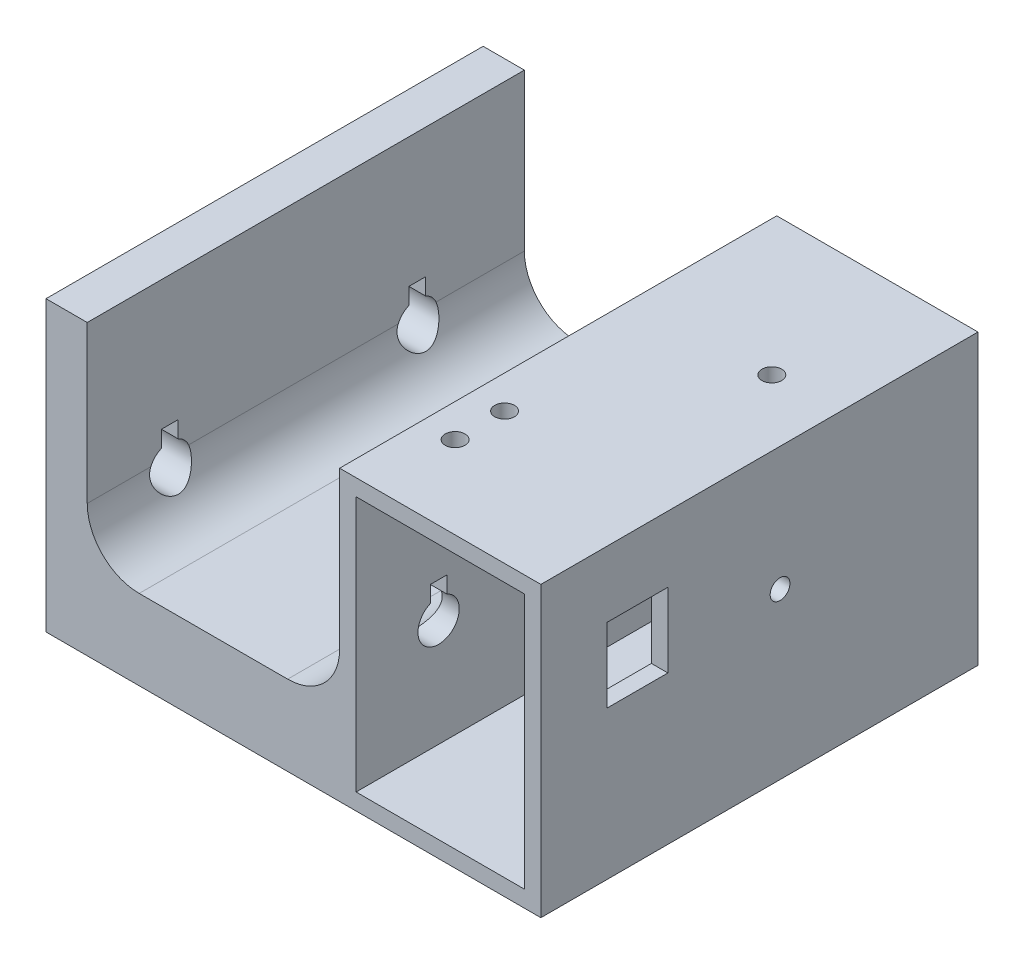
SolidWorks part; units mm, degrees
ref_plane "Front Plane" through (0, 0, 0) normal (0, 0, 1) x (1, 0, 0)
ref_plane "Top Plane" through (0, 0, 0) normal (0, 1, 0) x (1, 0, 0)
ref_plane "Right Plane" through (0, 0, 0) normal (1, 0, 0) x (0, 0, -1)
sketch "Sketch1" plane through (0, 0, 0) normal (0, 0, 1) x (1, 0, 0)
  line L0 (45.212, 44.45) -> (76.2, 44.45)
  line L1 (0, 0) -> (76.2, 0)
  line L2 (0, 0) -> (0, 44.45)
  line L3 (0, 44.45) -> (6.35, 44.45)
  line L4 (76.2, 0) -> (76.2, 44.45)
  line L6 (6.35, 44.45) -> (6.35, 20.32)
  line L7 (14.351, 12.319) -> (37.211, 12.319)
  line L8 (45.212, 44.45) -> (45.212, 20.32)
  arc A0 (37.211, 12.319) -> (45.212, 20.32) centre (37.211, 20.32) ccw
  arc A1 (6.35, 20.32) -> (14.351, 12.319) centre (14.351, 20.32) ccw
  point P11 (45.212, 12.319)
  point P14 (6.35, 12.319)
  dimension "D6" = 8.001
  dimension "D1" = 44.45
  dimension "D2" = 76.2
  dimension "D3" = 38.862
  dimension "D4" = 6.35
  dimension "D5" = 32.131
extrude "Boss-Extrude1" add sketch "Sketch1" along normal blind 67.31
sketch "Sketch3" plane through (0, 44.45, 0) normal (0, 1, 0) x (1, 0, 0)
  line L0 (45.212, -67.31) -> (45.212, 0) construction
  line L1 (76.2, 0) -> (45.212, 0) construction
  circle A0 centre (68.9864, -6.35) radius 1.5875
  dimension "D2" = 3.175
  dimension "D1" = 23.7744
  dimension "D3" = 6.35
extrude "Cut-Extrude2" [suppressed] cut sketch "Sketch3" against normal blind 12.7
sketch "Sketch4" plane through (0, 0, 67.31) normal (0, 0, 1) x (1, 0, 0)
  line L0 (76.2, 44.45) -> (45.212, 44.45) construction
  line L1 (47.752, 41.91) -> (73.66, 41.91)
  line L2 (47.752, 41.91) -> (47.752, 2.54)
  line L3 (47.752, 2.54) -> (73.66, 2.54)
  line L4 (73.66, 41.91) -> (73.66, 2.54)
  line L5 (76.2, 0) -> (76.2, 44.45) construction
  line L6 (0, 0) -> (76.2, 0) construction
  line L7 (45.212, 44.45) -> (45.212, 20.32) construction
  dimension "D1" = 2.54
  dimension "D2" = 2.54
  dimension "D3" = 2.54
  dimension "D4" = 2.54
extrude "Cut-Extrude3" cut sketch "Sketch4" against normal blind 63.5
sketch "Sketch2" plane through (0, 0, 0) normal (-1, 0, 0) x (0, 0, 1)
  line L0 (67.31, 44.45) -> (67.31, 0) construction
  line L1 (67.31, 44.45) -> (0, 44.45) construction
  line L2 (15.24, 21.9599) -> (15.24, 24.4999)
  line L3 (15.24, 24.4999) -> (17.78, 24.4999)
  line L4 (17.78, 24.4999) -> (17.78, 21.9599)
  line L5 (53.34, 21.9599) -> (53.34, 24.4999)
  line L6 (53.34, 24.4999) -> (55.88, 24.4999)
  line L7 (55.88, 24.4999) -> (55.88, 21.9599)
  arc A0 (53.34, 21.9599) -> (55.88, 21.9599) centre (54.61, 19.05) ccw
  arc A1 (15.24, 21.9599) -> (17.78, 21.9599) centre (16.51, 19.05) ccw
  dimension "D1" = 6.35
  dimension "D2" = 6.35
  dimension "D3" = 12.7
  dimension "D4" = 38.1
  dimension "D5" = 25.4
  dimension "D6" = 25.4
  dimension "D7" = 2.54
  dimension "D8" = 1.27
  dimension "D9" = 2.54
  dimension "D10" = 2.54
  dimension "D11" = 1.27
  dimension "D12" = 2.54
extrude "Cut-Extrude1" cut sketch "Sketch2" against normal up to surface (47.752 mm away)
sketch "Sketch5" plane through (0, 44.45, 0) normal (0, 1, 0) x (1, 0, 0)
  line L1 (76.2, -67.31) -> (76.2, 0) construction
  line L2 (76.2, -67.31) -> (45.212, -67.31) construction
  line L6 (76.2, 0) -> (45.212, 0) construction
  line L7 (45.212, -67.31) -> (45.212, 0) construction
  circle A0 centre (50.292, -46.99) radius 1.524
  circle A1 centre (50.292, -54.61) radius 1.524
  circle A2 centre (66.04, -21.59) radius 1.524
  dimension "D5" = 3.048
  dimension "D6" = 3.048
  dimension "D2" = 3.048
  dimension "D3" = 10.16
  dimension "D4" = 21.59
  dimension "D7" = 12.7
  dimension "D8" = 5.08
  dimension "D9" = 7.62
  dimension "D10" = 5.08
extrude "Cut-Extrude4" cut sketch "Sketch5" against normal up to surface (2.54 mm away)
sketch "Sketch6" plane through (76.2, 0, 0) normal (1, 0, 0) x (0, 0, -1)
  line L0 (-67.31, 44.45) -> (0, 44.45) construction
  line L1 (-57.15, 34.29) -> (-47.752, 34.29)
  line L2 (-57.15, 34.29) -> (-57.15, 22.86)
  line L3 (-57.15, 22.86) -> (-47.752, 22.86)
  line L4 (-47.752, 34.29) -> (-47.752, 22.86)
  line L5 (-67.31, 0) -> (-67.31, 44.45) construction
  line L6 (-67.31, 0) -> (0, 0) construction
  line L7 (0, 0) -> (0, 44.45) construction
  circle A0 centre (-30.48, 25.4) radius 1.524
  dimension "D5" = 3.048
  dimension "D1" = 11.43
  dimension "D2" = 9.398
  dimension "D3" = 10.16
  dimension "D4" = 10.16
  dimension "D6" = 25.4
  dimension "D7" = 30.48
extrude "Cut-Extrude5" cut sketch "Sketch6" against normal up to surface (2.54 mm away)
